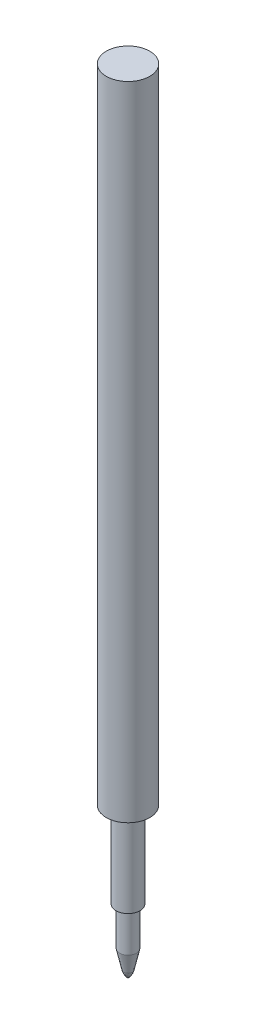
SolidWorks part; units mm, degrees
ref_plane "Front Plane" through (0, 0, 0) normal (0, 0, 1) x (1, 0, 0)
ref_plane "Top Plane" through (0, 0, 0) normal (0, 1, 0) x (1, 0, 0)
ref_plane "Right Plane" through (0, 0, 0) normal (1, 0, 0) x (0, 0, -1)
sketch "Sketch1" plane through (0, 0, 0) normal (0, 0, 1) x (1, 0, 0)
  line L0 (0, 0) -> (0, 111)
  line L1 (0, 111) -> (3.05, 111)
  line L2 (3.05, 111) -> (3.05, 21)
  line L3 (3.05, 21) -> (1.675, 21)
  line L4 (1.675, 21) -> (1.675, 9)
  line L5 (1.675, 9) -> (1.175, 9)
  line L6 (1.175, 9) -> (1.175, 3.6)
  line L8 (0, 0) -> (-0.7064, 0) construction
  line L9 (1.175, 3.6) -> (0.6, 1)
  arc A1 (0.6, 1) -> (0, 0) centre (-1.1949, 1.397) cw
  dimension "D1" = 111
  dimension "D2" = 3.05
  dimension "D3" = 1.675
  dimension "D4" = 1.175
  dimension "D5" = 90
  dimension "D6" = 12
  dimension "D7" = 2.6
  dimension "D8" = 0.6
  dimension "D9" = 1
revolve "Revolve1" add sketch "Sketch1" angle 360 about L0
